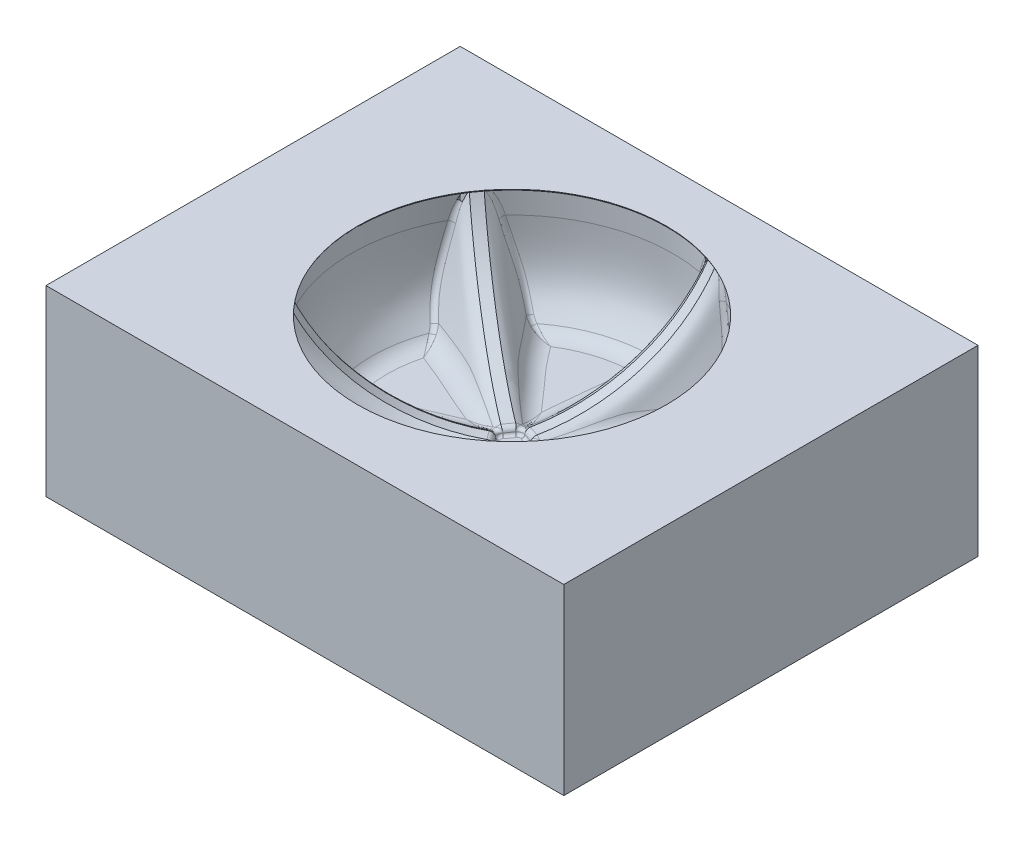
SolidWorks part; units mm, degrees
ref_plane "Front Plane" through (0, 0, 0) normal (0, 0, 1) x (1, 0, 0)
ref_plane "Top Plane" through (0, 0, 0) normal (0, 1, 0) x (1, 0, 0)
ref_plane "Right Plane" through (0, 0, 0) normal (1, 0, 0) x (0, 0, -1)
imported_body "Imported1"
sketch "Sketch1" plane through (0, 0, 0) normal (0, 0, 1) x (1, 0, 0)
  line L0 (12.2794, 66.9136) -> (-12.2794, 66.9136) construction
  line L1 (-50, -108.0864) -> (50, -108.0864)
  line L2 (-50, -108.0864) -> (-50, 66.9136)
  line L3 (-50, 66.9136) -> (50, 66.9136)
  line L4 (50, -108.0864) -> (50, 66.9136)
  line L5 (-50, -108.0864) -> (50, 66.9136) construction
  line L6 (-50, 66.9136) -> (50, -108.0864) construction
  point P0 (0, -20.5864)
  dimension "D1" = 175
  dimension "D2" = 100
extrude "Boss-Extrude1" add sketch "Sketch1" along normal mid plane 80 separate body
combine bodies "Combine3" operation type subtract main body 102 bodies to subtract 101
sketch "Sketch2" plane through (0, 66.9136, 0) normal (0, 1, 0) x (1, 0, 0)
  line L0 (-50, 0) -> (50, 0)
  line L1 (-50, -40) -> (-50, 40) construction
  line L2 (50, -40) -> (50, 40) construction
sketch "Sketch3" plane through (50, 0, 0) normal (1, 0, 0) x (0, 0, -1)
  line L0 (-40, -72.7693) -> (40, -72.7693)
  line L1 (-40, -108.0864) -> (-40, 66.9136) construction
  line L2 (-29.86, -72.7693) -> (29.86, -72.7693) construction
  line L4 (40, -108.0864) -> (40, 66.9136) construction
extrude "Cut-Extrude2" cut sketch "Sketch3" against normal through all and the other way through all
